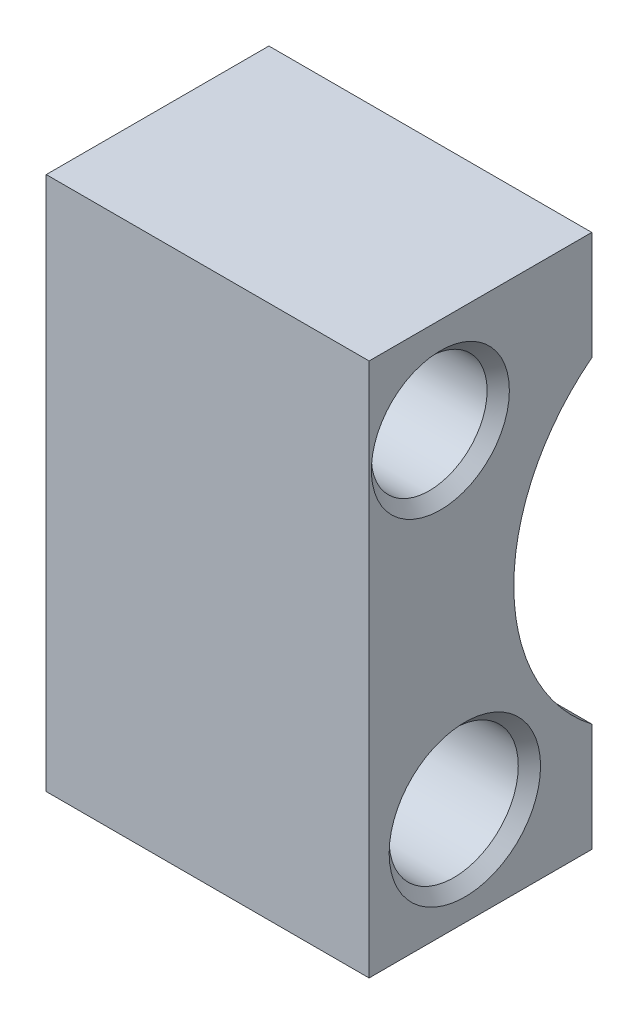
SolidWorks part; units mm, degrees
ref_plane "Face" through (0, 0, 0) normal (0, 0, 1) x (1, 0, 0)
ref_plane "Dessus" through (0, 0, 0) normal (0, 1, 0) x (1, 0, 0)
ref_plane "Droite" through (0, 0, 0) normal (1, 0, 0) x (0, 0, -1)
sketch "Esquisse1" plane through (0, 0, 0) normal (1, 0, 0) x (0, 0, -1)
  line L0 (-24.4636, 0) -> (16.8266, 0) construction
  line L1 (0, 18.1435) -> (0, -26.4139) construction
  line L3 (-15.5, 12) -> (-5.5, 12)
  line L4 (-15.5, 12) -> (-15.5, -12)
  line L5 (-15.5, -12) -> (-5.5, -12)
  line L6 (-5.5, 12) -> (-5.5, 7.1239)
  line L7 (-5.5, -7.1239) -> (-5.5, -12)
  arc A0 (-5.5, 7.1239) -> (-5.5, -7.1239) centre (0, 0) ccw
  dimension "D5" = 18
  dimension "D1" = 24
  dimension "D2" = 10
  dimension "D3" = 31
extrude "Base-Extrusion" add sketch "Esquisse1" along normal mid plane 14.5
sketch "Esquisse2" plane through (7.25, 0, 0) normal (1, 0, 0) x (0, 0, -1)
  circle A0 centre (-12.3, 7.7) radius 2.6
  circle A1 centre (-11.2, -7.6) radius 1.6
  dimension "D1" = 5.2
  dimension "D4" = 3.2
  dimension "D2" = 12.3
  dimension "D3" = 7.7
  dimension "D5" = 11.2
  dimension "D6" = 7.6
extrude "Enlèv. mat.-Extru.1" cut sketch "Esquisse2" against normal up to next
sketch "Esquisse3" plane through (7.25, 0, 0) normal (1, 0, 0) x (0, 0, -1)
  circle A0 centre (-11.2, -7.6) radius 2.9
  circle A1 centre (-11.2, -7.6) radius 1.6 construction
  dimension "D1" = 5.8
extrude "Enlèv. mat.-Extru.2" cut sketch "Esquisse3" against normal blind 9
chamfer "Chanfrein1" distance 0.5 angle 45 4 edges at (7.25, 7.7, 9.7) (-7.25, 7.7, 9.7) (-7.25, -7.6, 9.6) (7.25, -7.6, 8.3)
